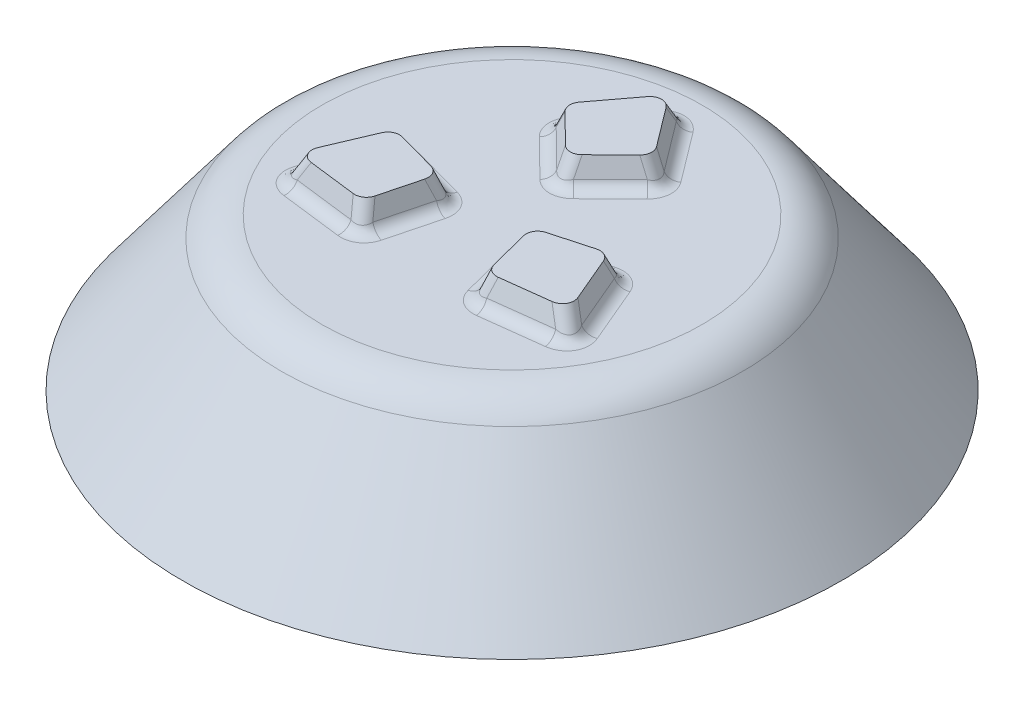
SolidWorks part; units mm, degrees
ref_plane "Front Plane" through (0, 0, 0) normal (0, 0, 1) x (1, 0, 0)
ref_plane "Top Plane" through (0, 0, 0) normal (0, 1, 0) x (1, 0, 0)
ref_plane "Right Plane" through (0, 0, 0) normal (1, 0, 0) x (0, 0, -1)
sketch "Sketch1" plane through (0, 0, 0) normal (1, 0, 0) x (0, 0, -1)
  line L0 (0, 0) -> (0, 11.8952) construction
  line L1 (0, 4) -> (7.5, 4)
  line L2 (7.5, 4) -> (10.5, 0)
  line L3 (10.5, 0) -> (13, 0)
  line L4 (13, 0) -> (8.5, 6)
  line L5 (8.5, 6) -> (0, 6)
  line L8 (0, 6) -> (0, 4)
  dimension "D1" = 13
  dimension "D2" = 6
  dimension "D4" = 2
  dimension "D5" = 2
  dimension "D6" = 8.5
revolve "Revolve1" add sketch "Sketch1" angle 360 about L0
sketch "Sketch2" plane through (0, 6, 0) normal (0, 1, 0) x (1, 0, 0)
  line L0 (0, 6.8) -> (-2.25, 3.8162)
  line L1 (-2.25, 3.8162) -> (0, 1.6)
  line L2 (0, 1.6) -> (2.25, 3.8162)
  line L3 (2.25, 3.8162) -> (0, 6.8)
  line L4 (0, 0) -> (0, 6.8) construction
  dimension "D1" = 4.5
  dimension "D2" = 5.2
  dimension "D3" = 6.8
  dimension "D4" = 2.2162
  dimension "D5" = 3.7371
extrude "Boss-Extrude1" add sketch "Sketch2" along normal blind 1 draft 20
pattern_circular "CirPattern1" count 3 over 360 about axis through (0, 0, 0) along (0, 1, 0) of "Boss-Extrude1"
sketch "Sketch3" plane through (0, 0, 0) normal (1, 0, 0) x (0, 0, -1)
  line L3 (0, 0) -> (0, 9.1813) construction
  line L10 (8.5, 6) -> (-8.5, 6) construction
  line L12 (13, 0) -> (8.5, 6) construction
  line L13 (8.5, 6) -> (0, 6)
  line L14 (0, 7.5) -> (0, 6)
  line L15 (13, 0) -> (8.5, 6)
  line L16 (14.875, 0) -> (9.85, 6.7)
  line L17 (8.25, 7.5) -> (0, 7.5)
  line L18 (13, 0) -> (14.875, 0)
  line L19 (14.2, 0.9) -> (9.25, 7.5) construction
  line L20 (9.25, 7.5) -> (0, 7.5) construction
  arc A0 (9.85, 6.7) -> (8.25, 7.5) centre (8.25, 5.5) ccw
  dimension "D2" = 2
  dimension "D1" = 1.5
fillet "Fillet1" radius 2 1 edges at (0, 6, -8.5)
fillet "Fillet2" radius 0.5 24 edges at (-2.3159, 6.5, 3.6565) (-1.6069, 6.5, 0.9277) (-4.3246, 6.5, 0.1774) (-5.6272, 6.5, 3.2489) (4.3246, 6.5, 0.1774) (1.6069, 6.5, 0.9277) (2.3159, 6.5, 3.6565) (5.6272, 6.5, 3.2489) (-2.0087, 6.5, -3.8339) (0, 6.5, -1.8554) (0, 6.5, -6.4977) (2.0087, 6.5, -3.8339) (-1.7828, 6, 2.3283) (-2.9078, 6, 0.3798) (-5.1594, 6, 1.6798) (-4.0344, 6, 3.6283) (2.9078, 6, 0.3798) (1.7828, 6, 2.3283) (4.0344, 6, 3.6283) (-1.125, 6, -2.7081) (1.125, 6, -2.7081) (1.125, 6, -5.3081) (-1.125, 6, -5.3081) (5.1594, 6, 1.6798)
